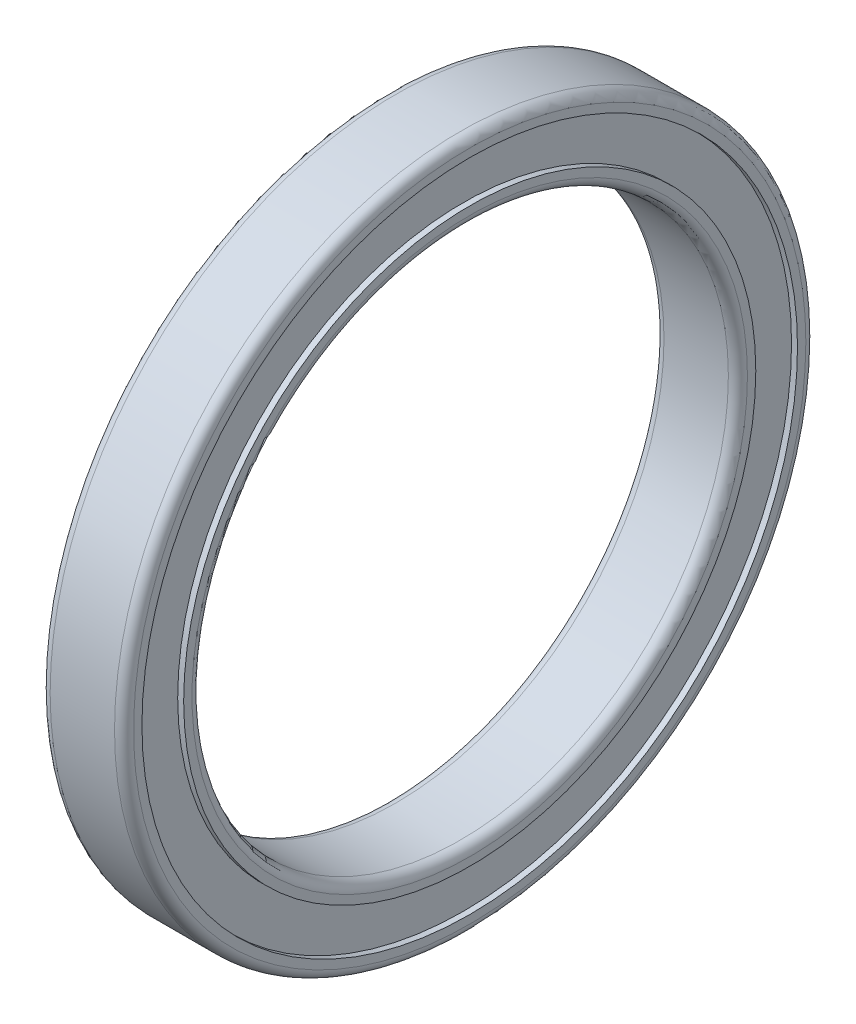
SolidWorks part; units mm, degrees
ref_plane "Спереди" through (0, 0, 0) normal (0, 0, 1) x (1, 0, 0)
ref_plane "Сверху" through (0, 0, 0) normal (0, 1, 0) x (1, 0, 0)
ref_plane "Справа" through (0, 0, 0) normal (1, 0, 0) x (0, 0, -1)
sketch "Эскиз1" plane through (0, 0, 0) normal (0, 0, 1) x (1, 0, 0)
  line L0 (0, 0) -> (-18.1184, 0) construction
  line L1 (0, 0) -> (0, 22.9845) construction
  line L2 (3.5, 22.5) -> (-3.5, 22.5)
  line L3 (-3.5, 22.5) -> (-3.5, 24)
  line L4 (-3, 24) -> (-3.5, 24)
  line L5 (-3, 24) -> (-3, 27.5)
  line L6 (-3, 27.5) -> (-3.5, 27.5)
  line L7 (-3.5, 27.5) -> (-3.5, 29)
  line L8 (-3.5, 29) -> (3.5, 29)
  line L9 (3.5, 27.5) -> (3.5, 29)
  line L10 (3, 27.5) -> (3.5, 27.5)
  line L11 (3, 24) -> (3, 27.5)
  line L12 (3, 24) -> (3.5, 24)
  line L13 (3.5, 22.5) -> (3.5, 24)
  point P13 (0, 29)
  point P18 (0, 22.5)
  dimension "D1" = 45
  dimension "D2" = 58
  dimension "D3" = 7
  dimension "D4" = 0.5
  dimension "D5" = 1.5
revolve "Повернуть1" add sketch "Эскиз1" angle 360 about L0
fillet "Скругление1" radius 0.8 4 edges at (3.5, 0, -29) (-3.5, 0, -29) (-3.5, 0, -22.5) (3.5, 0, -22.5)
